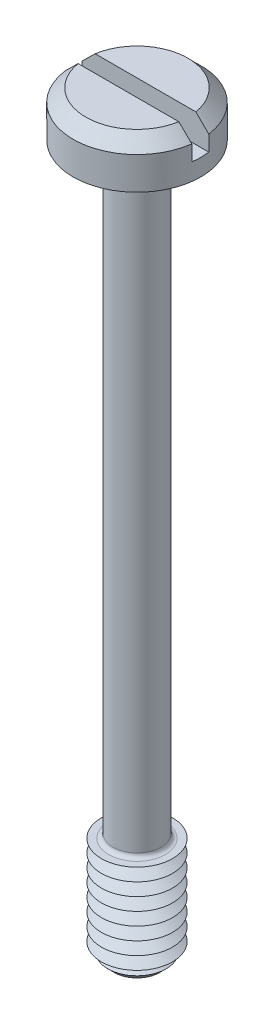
SolidWorks part; units mm, degrees
ref_plane "Front Plane" through (0, 0, 0) normal (0, 0, 1) x (1, 0, 0)
ref_plane "Top Plane" through (0, 0, 0) normal (0, 1, 0) x (1, 0, 0)
ref_plane "Right Plane" through (0, 0, 0) normal (1, 0, 0) x (0, 0, -1)
sketch "Sketch1" plane through (0, 0, 0) normal (0, 1, 0) x (1, 0, 0)
  circle A0 centre (0, 0) radius 2.25
  dimension "D1" = 4.5
extrude "Boss-Extrude1" add sketch "Sketch1" along normal blind 1.6
sketch "Sketch2" plane through (0, 0, 0) normal (0, -1, 0) x (1, 0, 0)
  circle A0 centre (0, 0) radius 0.85
  dimension "D1" = 1.7
extrude "Boss-Extrude2" add sketch "Sketch2" along normal blind 25
sketch "Sketch3" plane through (0, -25, 0) normal (0, -1, 0) x (1, 0, 0)
  circle A0 centre (0, 0) radius 1.25
  dimension "D1" = 2.5
extrude "Boss-Extrude3" add sketch "Sketch3" against normal blind 3.7
chamfer "Chamfer1" distance 0.45 angle 45 1 edges at (0, -25, -1.25)
sketch "Sketch4" plane through (0, 0, 0) normal (1, 0, 0) x (0, 0, -1)
  line L0 (0, -6.5871) -> (0, -12.0372) construction
sketch "Sketch5" plane through (0, 0, 0) normal (1, 0, 0) x (0, 0, -1)
  line L0 (-1.25, -21.3) -> (-0.8603, -21.525)
  line L1 (-0.8603, -21.525) -> (-1.25, -21.75)
  line L2 (-1.25, -21.3) -> (-1.25, -24.55) construction
  line L3 (-1.25, -21.75) -> (-1.25, -21.3)
  dimension "D1" = 0.45
revolve "Cut-Revolve1" cut sketch "Sketch5" angle 360 about L0
pattern_linear "LPattern1" count 8 spacing 0.45 along (0, -1, 0) of "Cut-Revolve1"
fillet "Fillet1" radius 0.15 2 edges at (0, -21.3, -0.85) (0, 0, -0.85)
chamfer "Chamfer2" distance 0.45 angle 45 1 edges at (0, 1.6, 2.25)
sketch "Sketch6" plane through (0, 1.6, 0) normal (0, 1, 0) x (1, 0, 0)
  line L1 (2.25, -0.3) -> (-2.25, -0.3)
  line L2 (2.25, -0.3) -> (2.25, 0.3)
  line L3 (2.25, 0.3) -> (-2.25, 0.3)
  line L4 (-2.25, -0.3) -> (-2.25, 0.3)
  line L5 (2.25, -0.3) -> (-2.25, 0.3) construction
  line L6 (2.25, 0.3) -> (-2.25, -0.3) construction
  circle A0 centre (0, 0) radius 2.25 construction
  point P0 (0, 0)
  dimension "D1" = 0.6
extrude "Cut-Extrude1" cut sketch "Sketch6" against normal blind 1
